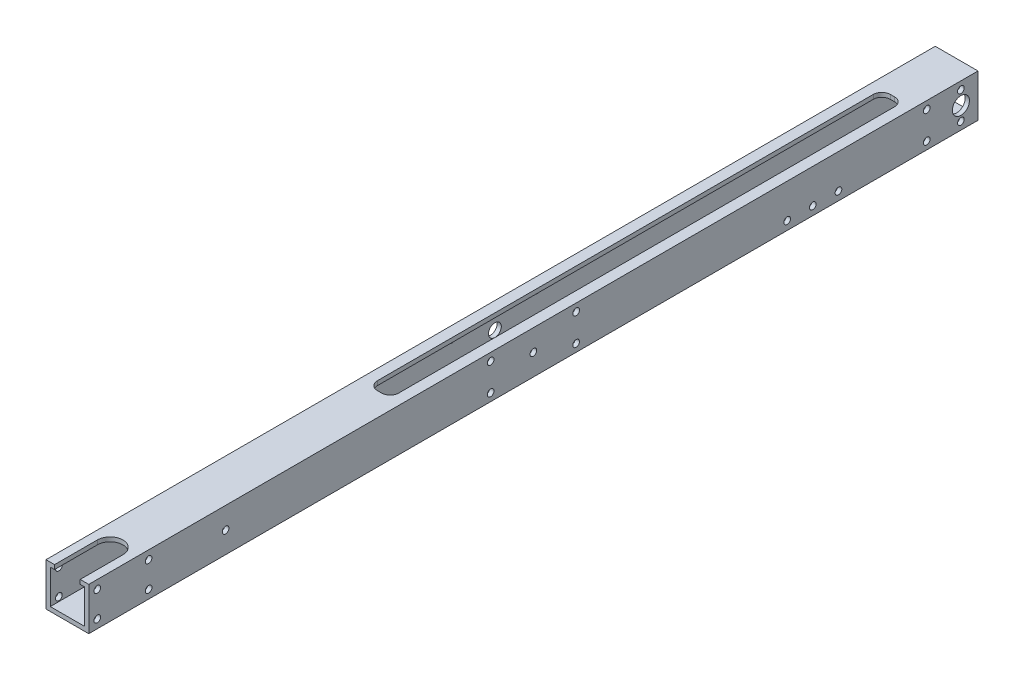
SolidWorks part; units mm, degrees
ref_plane "Front" through (0, 0, 0) normal (0, 0, 1) x (1, 0, 0)
ref_plane "Top" through (0, 0, 0) normal (0, 1, 0) x (1, 0, 0)
ref_plane "Right" through (0, 0, 0) normal (1, 0, 0) x (0, 0, -1)
sketch "Sketch1" plane through (0, 0, 0) normal (0, 0, 1) x (1, 0, 0)
  line L0 (-15.875, -15.875) -> (15.875, -15.875)
  line L1 (-15.875, -15.875) -> (-15.875, 15.875)
  line L2 (15.875, -15.875) -> (15.875, 15.875)
  line L3 (-15.875, 15.875) -> (15.875, 15.875)
  line L4 (-15.875, -15.875) -> (15.875, 15.875) construction
  line L5 (15.875, -15.875) -> (-15.875, 15.875) construction
  line L6 (-12.7, 12.7) -> (12.7, 12.7)
  line L7 (12.7, -12.7) -> (12.7, 12.7)
  line L8 (-12.7, -12.7) -> (12.7, -12.7)
  line L9 (-12.7, -12.7) -> (-12.7, 12.7)
  point P1 (0, 0)
  dimension "D1" = 31.75
  dimension "D2" = 3.175
extrude "Boss-Extrude1" add sketch "Sketch1" along normal blind 660.4
sketch "Sketch2" plane through (15.875, 0, 0) normal (1, 0, 0) x (0, 0, -1)
  line L0 (0, 0) -> (-660.4, 0) construction
  line L1 (-660.4, -15.875) -> (-660.4, 15.875) construction
  line L2 (-298.45, 10.16) -> (-38.1, 10.16) construction
  line L3 (-298.45, -10.16) -> (-361.95, -10.16) construction
  line L4 (-298.45, -10.16) -> (-298.45, 10.16) construction
  line L5 (-298.45, 10.16) -> (-361.95, 10.16) construction
  line L6 (-361.95, -10.16) -> (-361.95, 10.16) construction
  line L7 (-298.45, -10.16) -> (-361.95, 10.16) construction
  line L8 (-298.45, 10.16) -> (-361.95, -10.16) construction
  line L9 (-38.1, 10.16) -> (-38.1, -10.16) construction
  line L10 (-38.1, -10.16) -> (-298.45, -10.16) construction
  line L11 (-38.1, 10.16) -> (-12.7, 10.16) construction
  line L12 (-12.7, 10.16) -> (-12.7, -10.16) construction
  line L13 (-12.7, -10.16) -> (-38.1, -10.16) construction
  line L14 (-660.4, -15.875) -> (0, -15.875) construction
  line L16 (-73.0743, -9.525) -> (-149.2787, -9.525) construction
  circle A0 centre (-12.7, 0) radius 2.4892
  circle A1 centre (-330.2, 0) radius 2.4892
  circle A2 centre (-361.95, 10.16) radius 2.4892
  circle A3 centre (-298.45, 10.16) radius 2.4892
  circle A4 centre (-298.45, -10.16) radius 2.4892
  circle A5 centre (-361.95, -10.16) radius 2.4892
  circle A6 centre (-38.1, 10.16) radius 2.4892
  circle A7 centre (-38.1, -10.16) radius 2.4892
  circle A8 centre (-12.7, 10.16) radius 2.4892
  circle A9 centre (-12.7, -10.16) radius 2.4892
  circle A10 centre (-103.632, -9.525) radius 2.4892
  circle A11 centre (-84.582, -9.525) radius 2.4892 construction
  circle A12 centre (-122.682, -9.525) radius 2.4892
  circle A13 centre (-141.732, -9.525) radius 2.4892
  dimension "D1" = 4.9784
  dimension "D3" = 4.9784
  dimension "D6" = 4.9784
  dimension "D2" = 12.7
  dimension "D4" = 63.5
  dimension "D5" = 20.32
  dimension "D7" = 260.35
  dimension "D8" = 25.4
  dimension "D9" = 129.032
  dimension "D10" = 19.05
  dimension "D11" = 19.05
  dimension "D12" = 19.05
  dimension "D13" = 6.35
extrude "Cut-Extrude1" cut sketch "Sketch2" against normal through all
sketch "Sketch4" plane through (-15.875, 0, 0) normal (-1, 0, 0) x (0, 0, 1)
  circle A0 centre (330.2, 0) radius 4.7625
  dimension "D1" = 9.525
extrude "Cut-Extrude2" cut sketch "Sketch4" against normal blind 12.7
sketch "Sketch5" plane through (15.875, 0, 0) normal (1, 0, 0) x (0, 0, -1)
  circle A0 centre (-12.7, 0) radius 6.35
  dimension "D1" = 12.7
extrude "Cut-Extrude3" cut sketch "Sketch5" against normal up to next
sketch "Sketch6" plane through (0, 15.875, 0) normal (0, 1, 0) x (1, 0, 0)
  line L0 (15.875, -660.4) -> (-15.875, -660.4) construction
  line L1 (-9.525, -660.4) -> (9.525, -660.4)
  line L2 (-9.525, -660.4) -> (-9.525, -628.65)
  line L3 (-9.525, -628.65) -> (9.525, -628.65) construction
  line L4 (9.525, -660.4) -> (9.525, -628.65)
  line L5 (-15.875, -660.4) -> (-15.875, 0) construction
  line L6 (15.875, -660.4) -> (15.875, 0) construction
  arc A0 (-9.525, -628.65) -> (9.525, -628.65) centre (0, -628.65) cw
  dimension "D1" = 6.35
  dimension "D2" = 6.35
  dimension "D3" = 31.75
extrude "Cut-Extrude4" cut sketch "Sketch6" against normal up to next
sketch "Sketch7" plane through (-15.875, 0, 0) normal (-1, 0, 0) x (0, 0, 1)
  line L4 (0, 15.875) -> (0, -15.875)
  line L5 (0, -15.875) -> (660.4, -15.875)
  line L6 (660.4, -15.875) -> (660.4, 15.875)
  line L7 (660.4, 15.875) -> (0, 15.875)
  line L8 (0, 15.875) -> (0, -15.875) construction
  line L9 (0, -15.875) -> (660.4, -15.875) construction
  line L10 (660.4, -15.875) -> (660.4, 15.875) construction
  line L11 (660.4, 15.875) -> (0, 15.875) construction
  arc A1 (558.7746, -3.175) -> (558.7746, 3.175) centre (558.7746, 0) ccw construction
  circle A2 centre (558.7746, 0) radius 2.4892
  dimension "D2" = 4.9784
  dimension "D1" = 0
extrude "Cut-Extrude5" cut sketch "Sketch7" against normal through all
sketch "Sketch8" plane through (15.875, 0, 0) normal (1, 0, 0) x (0, 0, -1)
  circle A0 centre (-654.05, 9.525) radius 2.4892 construction
  circle A1 centre (-654.05, -9.525) radius 2.4892 construction
  circle A2 centre (-615.95, 9.525) radius 2.4892 construction
  circle A3 centre (-615.95, -9.525) radius 2.4892 construction
  circle A4 centre (-654.05, 9.525) radius 2.4892
  circle A5 centre (-654.05, -9.525) radius 2.4892
  circle A6 centre (-615.95, 9.525) radius 2.4892
  circle A7 centre (-615.95, -9.525) radius 2.4892
extrude "Cut-Extrude6" cut sketch "Sketch8" against normal through all
sketch "Sketch9" plane through (0, 15.875, 0) normal (0, 1, 0) x (1, 0, 0)
  line L0 (0, -47.625) -> (0, 0)
  line L1 (-7.9375, -47.625) -> (7.9375, -47.625)
  line L2 (-7.9375, -47.625) -> (-7.9375, -428.625)
  line L3 (-7.9375, -428.625) -> (7.9375, -428.625)
  line L4 (7.9375, -47.625) -> (7.9375, -428.625)
  line L5 (15.875, 0) -> (-15.875, 0) construction
  dimension "D1" = 15.875
  dimension "D2" = 47.625
  dimension "D3" = 381
extrude "Cut-Extrude7" cut sketch "Sketch9" against normal blind 3.175 contours L4 L1 L2 L3
fillet "Fillet1" radius 6.35 4 edges at (7.9375, 14.2875, 428.625) (-7.9375, 14.2875, 428.625) (-7.9375, 14.2875, 47.625) (7.9375, 14.2875, 47.625)
